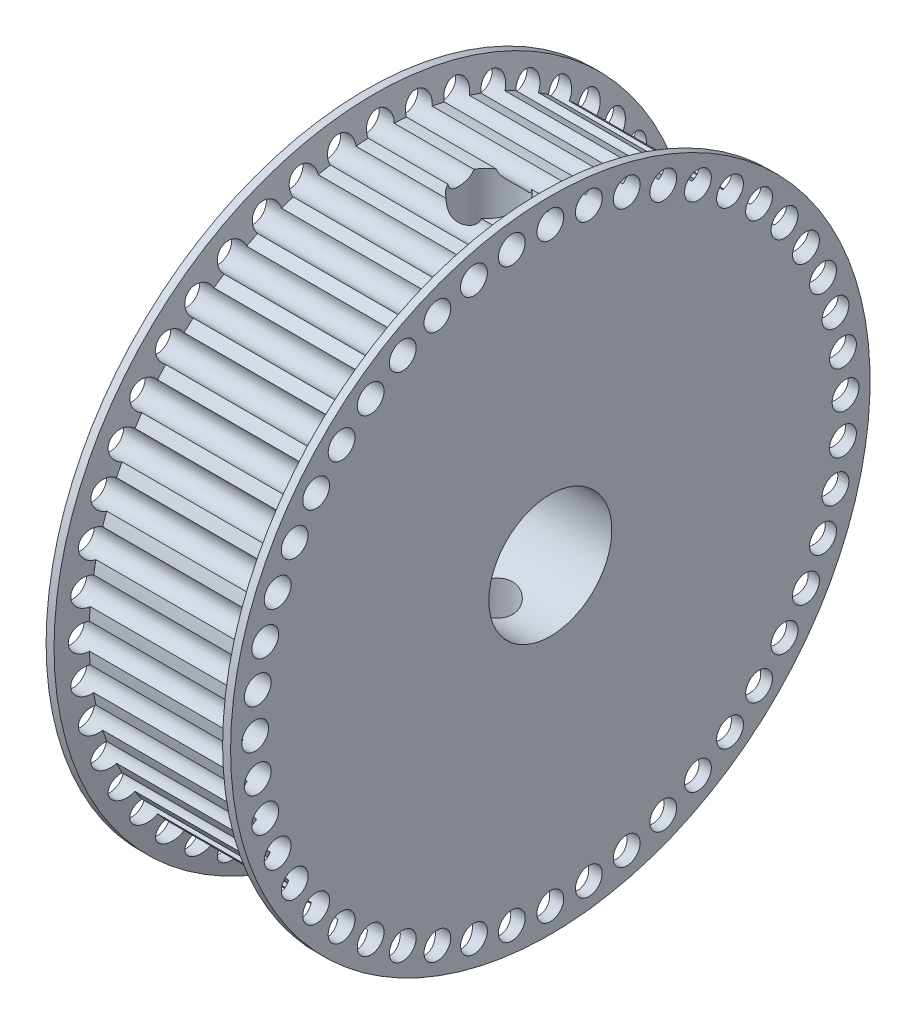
SolidWorks part; units mm, degrees
ref_plane "Front Plane" through (0, 0, 0) normal (0, 0, 1) x (1, 0, 0)
ref_plane "Top Plane" through (0, 0, 0) normal (0, 1, 0) x (1, 0, 0)
ref_plane "Right Plane" through (0, 0, 0) normal (1, 0, 0) x (0, 0, -1)
sketch "Sketch1" plane through (0, 0, 0) normal (0, 0, 1) x (1, 0, 0)
  line L0 (0, 75.6294) -> (0, -50.5482) construction
  line L1 (-51.4164, 0) -> (59.1337, 0) construction
  line L2 (-19.05, 12.7) -> (19.05, 12.7)
  line L3 (19.05, 12.7) -> (19.05, 66.04)
  line L4 (19.05, 66.04) -> (17.4063, 66.04)
  line L5 (17.4063, 66.04) -> (15.875, 60.325)
  line L6 (15.875, 60.325) -> (-15.875, 60.325)
  line L7 (0, 60.325) -> (0, 12.7)
  line L8 (-19.05, 12.7) -> (-19.05, 66.04)
  line L9 (-19.05, 66.04) -> (-17.4063, 66.04)
  line L10 (-17.4063, 66.04) -> (-15.875, 60.325)
  dimension "D1" = 19.05
  dimension "D2" = 12.7
  dimension "D3" = 66.04
  dimension "D4" = 60.325
  dimension "D5" = 1.6437
  dimension "D6" = 15.875
  dimension "D7" = 75
revolve "Revolve2" add sketch "Sketch1" angle 360 about L1
sketch "Sketch3" plane through (19.05, 0, 0) normal (1, 0, 0) x (0, 0, -1)
  circle A0 centre (0, 60.96) radius 2.7686
  dimension "D1" = 5.5372
  dimension "D2" = 60.96
extrude "Cut-Extrude2" cut sketch "Sketch3" against normal through all
pattern_circular "CirPattern1" count 48 over 360 about axis through (0, 0, 0) along (1, 0, 0) of "Cut-Extrude2"
ref_plane "Plane1" through (0, 63.5, 0) normal (0, 1, 0) x (-1, 0, 0)
sketch "Sketch5" plane through (0, 63.5, 0) normal (0, 1, 0) x (-1, 0, 0)
  circle A0 centre (-6.35, 0) radius 3.175
  dimension "D1" = 6.35
  dimension "D2" = 6.35
extrude "Cut-Extrude3" cut sketch "Sketch5" against normal through all
sketch "Sketch6" plane through (0, 63.5, 0) normal (0, 1, 0) x (-1, 0, 0)
  circle A0 centre (-6.35, 0) radius 4.8895
  dimension "D1" = 9.779
  dimension "D2" = 6.35
extrude "Cut-Extrude4" cut sketch "Sketch6" against normal blind 120.65
sketch "Sketch7" plane through (0, 63.5, 0) normal (0, 1, 0) x (-1, 0, 0)
  circle A0 centre (-6.35, 0) radius 6.35
  dimension "D1" = 12.7
extrude "Cut-Extrude5" cut sketch "Sketch7" against normal blind 19.05
